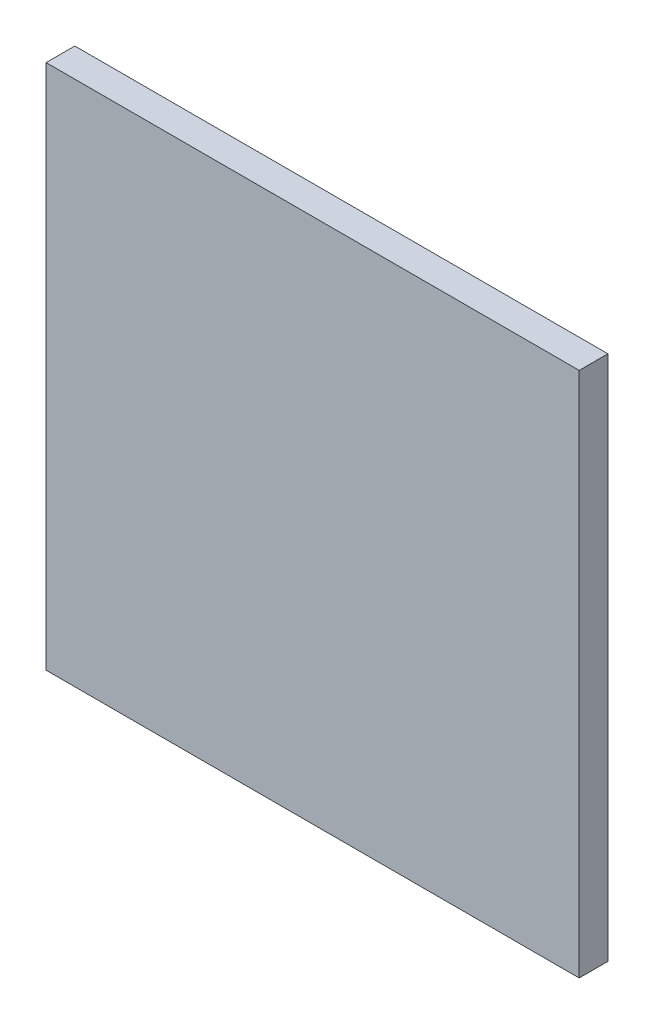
SolidWorks part; units mm, degrees
ref_plane "Face" through (0, 0, 0) normal (0, 0, 1) x (1, 0, 0)
ref_plane "Dessus" through (0, 0, 0) normal (0, 1, 0) x (1, 0, 0)
ref_plane "Droite" through (0, 0, 0) normal (1, 0, 0) x (0, 0, -1)
sketch "Esquisse1" plane through (0, 0, 0) normal (0, 0, 1) x (1, 0, 0)
  line L1 (0, 0) -> (19.3, 0)
  line L2 (0, 0) -> (0, 19.05)
  line L3 (0, 19.05) -> (19.3, 19.05)
  line L4 (19.3, 0) -> (19.3, 19.05)
  dimension "D1" = 19.3
  dimension "D2" = 19.05
extrude "Extrusion1" add sketch "Esquisse1" along normal blind 1.04
